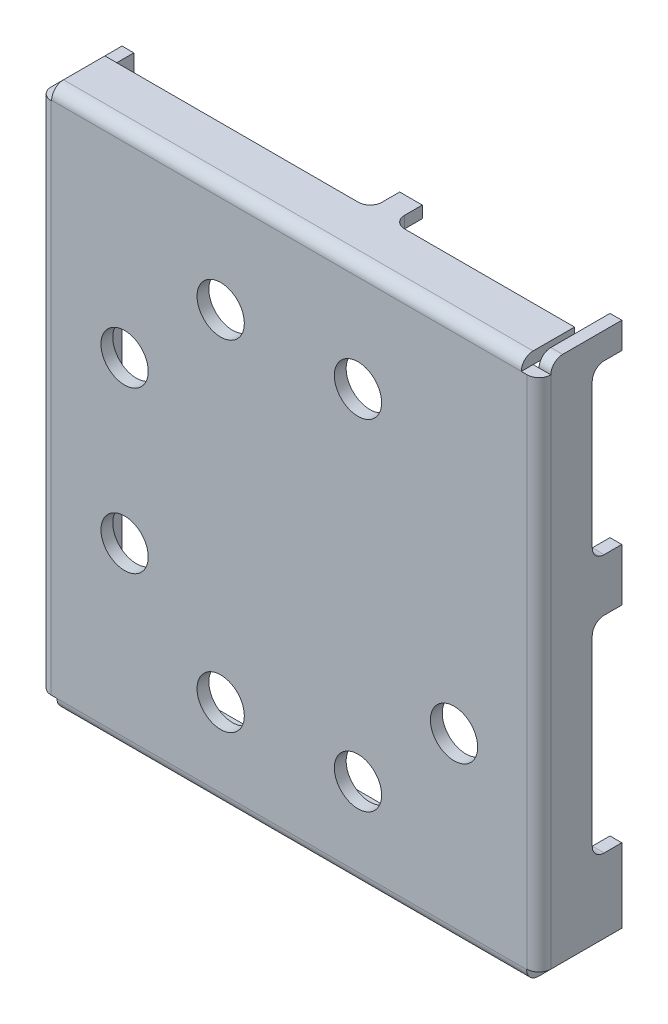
SolidWorks part; units mm, degrees
ref_plane "Front Plane" through (0, 0, 0) normal (0, 0, 1) x (1, 0, 0)
ref_plane "Top Plane" through (0, 0, 0) normal (0, 1, 0) x (1, 0, 0)
ref_plane "Right Plane" through (0, 0, 0) normal (1, 0, 0) x (0, 0, -1)
imported_body "Imported9"
sketch "Sketch1" plane through (0, 9.4536, 0) normal (0, 1, 0) x (1, 0, 0)
  line L1 (0.69, -1.4) -> (0.49, -1.4)
  line L2 (0.69, -1.4) -> (0.69, 0)
  line L3 (0.69, 0) -> (0.49, 0)
  line L4 (0.49, -1.4) -> (0.49, 0)
extrude "Cut-Extrude1" cut sketch "Sketch1" against normal blind 0.01
sketch "Sketch2" plane through (0.69, 0, 0) normal (-1, 0, 0) x (0, 0, 1)
  line L1 (0.5, 9.6536) -> (1.4, 9.6536)
  line L2 (0.5, 9.6536) -> (0.5, 9.4436)
  line L3 (0.5, 9.4436) -> (1.4, 9.4436)
  line L4 (1.4, 9.6536) -> (1.4, 9.4436)
extrude "Cut-Extrude2" cut sketch "Sketch2" against normal blind 0.01
sketch "Sketch3" plane through (8.7435, 0, 0) normal (1, 0, 0) x (0, 0, -1)
  line L1 (-0.2, 0.5367) -> (-1.4, 0.5367)
  line L2 (-0.2, 0.5367) -> (-0.2, 0.7367)
  line L3 (-0.2, 0.7367) -> (-1.4, 0.7367)
  line L4 (-1.4, 0.5367) -> (-1.4, 0.7367)
extrude "Cut-Extrude3" cut sketch "Sketch3" against normal blind 0.01
sketch "Sketch4" plane through (0, 0.7367, 0) normal (0, -1, 0) x (1, 0, 0)
  line L1 (8.9435, 0) -> (8.7435, 0)
  line L2 (8.9435, 0) -> (8.9435, 1.4)
  line L3 (8.9435, 1.4) -> (8.7435, 1.4)
  line L4 (8.7435, 0) -> (8.7435, 1.4)
extrude "Cut-Extrude4" cut sketch "Sketch4" against normal blind 0.01
